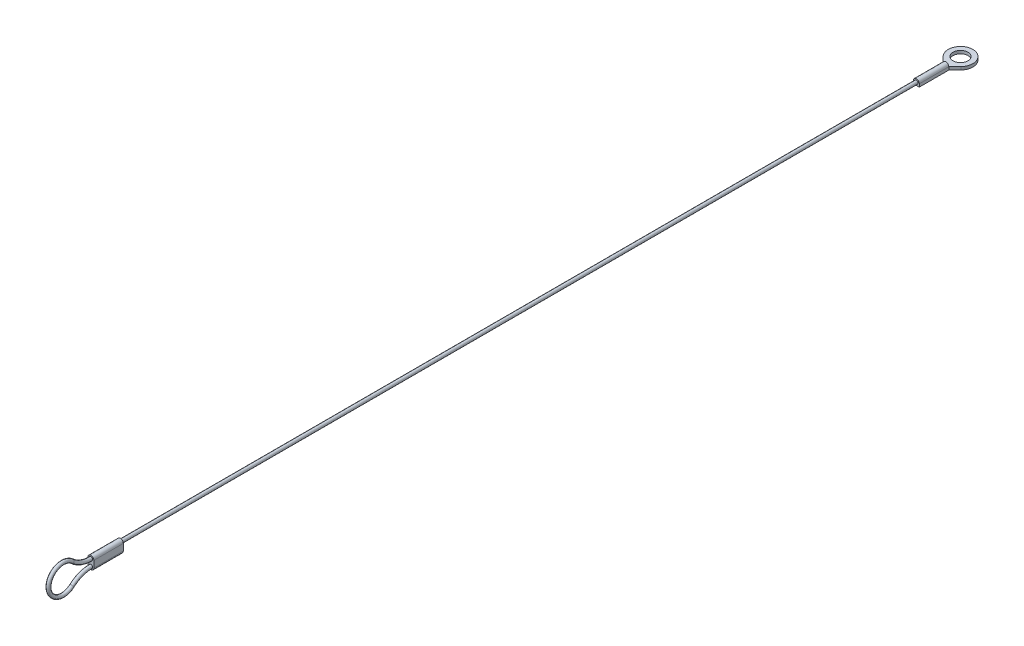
SolidWorks part; units mm, degrees
ref_plane "Front Plane" through (0, 0, 0) normal (0, 0, 1) x (1, 0, 0)
ref_plane "Top Plane" through (0, 0, 0) normal (0, 1, 0) x (1, 0, 0)
ref_plane "Right Plane" through (0, 0, 0) normal (1, 0, 0) x (0, 0, -1)
sketch "Sketch1" plane through (0, 0, 0) normal (1, 0, 0) x (0, 0, -1)
  line L2 (-280.2, 0) -> (0, 0)
  arc A0 (-280.2, 0) -> (-286.6, 2.4446) centre (-280.2, 9.6) cw
  arc A1 (-286.6, 2.4446) -> (-286.6, -4.7108) centre (-289.8, -1.1331) ccw
  arc A2 (-286.6, -4.7108) -> (-280.2, -2.2663) centre (-280.2, -11.8663) cw
  dimension "D1" = 4.8
  dimension "D4" = 9.6
  dimension "D2" = 289.8
  dimension "D3" = 9.6
sketch "Sketch2" plane through (0, 0, 0) normal (0, 0, 1) x (1, 0, 0)
  circle A0 centre (0, 0) radius 0.595
  dimension "D1" = 1.19
sweep "Sweep1" add profiles "Sketch2" path "Sketch1"
sketch "Sketch3" plane through (0, 0, 280.2) normal (0, 0, -1) x (-1, 0, 0)
  line L0 (0, 0) -> (0, -2.2663) construction
  line L1 (0.995, 0) -> (0.995, -2.2663)
  line L2 (-0.995, 0) -> (-0.995, -2.2663)
  line L3 (-0.595, -2.2663) -> (0.595, -2.2663) construction
  arc A0 (0.995, 0) -> (-0.995, 0) centre (0, 0) ccw
  arc A1 (-0.995, -2.2663) -> (0.995, -2.2663) centre (0, -2.2663) ccw
  point P3 (0, -1.1331)
  dimension "D1" = 1.99
extrude "Boss-Extrude1" add sketch "Sketch3" along normal blind 10
sketch "Sketch4" plane through (0, 0, 0) normal (0, 0, -1) x (-1, 0, 0)
  line L0 (-0.995, 0) -> (-0.995, -0.995)
  line L1 (-0.995, -0.995) -> (0, -0.995)
  line L2 (0, -0.995) -> (0.995, -0.995)
  line L3 (0.995, -0.995) -> (0.995, 0)
  arc A0 (0.995, 0) -> (-0.995, 0) centre (0, 0) ccw
  dimension "D1" = 1.99
extrude "Boss-Extrude2" add sketch "Sketch4" along normal blind 10
sketch "Sketch5" plane through (0, -0.995, 0) normal (0, -1, 0) x (1, 0, 0)
  line L0 (-0.995, -10) -> (0.995, -10)
  line L1 (0.995, -10) -> (3.0131, -12.0884)
  line L2 (-3.0131, -12.0884) -> (-0.995, -10)
  arc A0 (3.0131, -12.0884) -> (-3.0131, -12.0884) centre (0, -15) cw
  circle A1 centre (0, -15) radius 2.54
  point P8 (-4.19, -15)
  point P9 (4.19, -15)
  dimension "D1" = 5.08
  dimension "D2" = 8.38
  dimension "D3" = 15
extrude "Boss-Extrude3" add sketch "Sketch5" against normal blind 1.01
